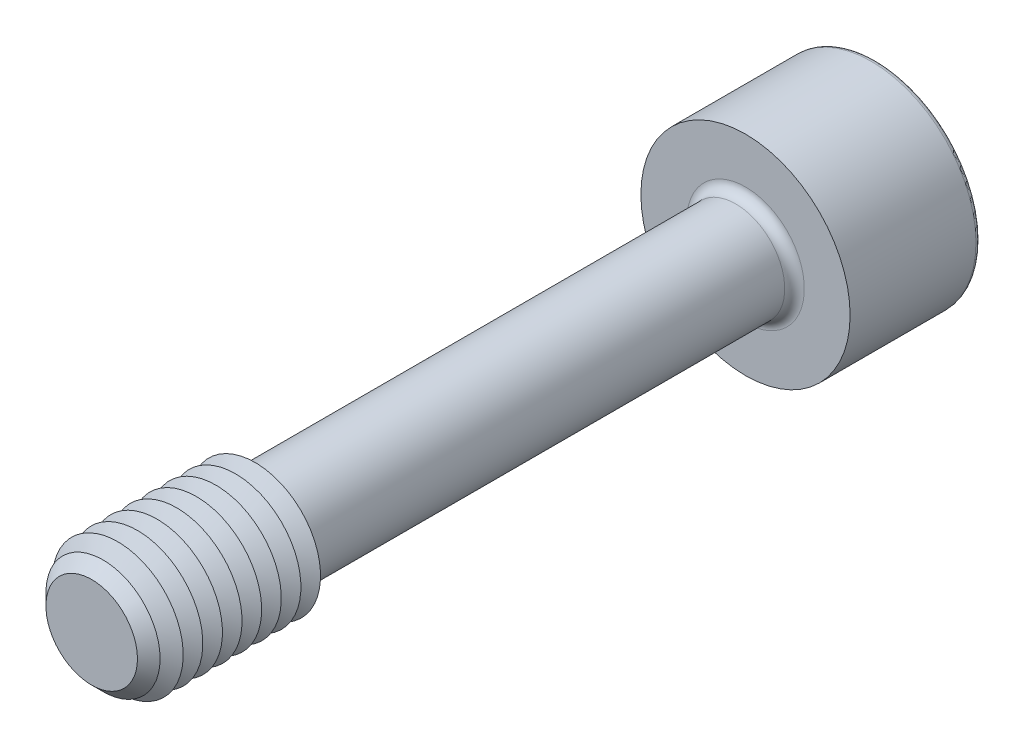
SolidWorks part; units mm, degrees
ref_plane "Front Plane" through (0, 0, 0) normal (0, 0, 1) x (1, 0, 0)
ref_plane "Top Plane" through (0, 0, 0) normal (0, 1, 0) x (1, 0, 0)
ref_plane "Right Plane" through (0, 0, 0) normal (1, 0, 0) x (0, 0, -1)
sketch "Sketch1" plane through (0, 0, 0) normal (0, 0, 1) x (1, 0, 0)
  circle A0 centre (0, 0) radius 3.75
  dimension "D1" = 7.5
extrude "Extrude1" add sketch "Sketch1" along normal mid plane 50
sketch "Sketch2" plane through (0, 0, 0) normal (1, 0, 0) x (0, 0, -1)
  line L0 (-25, 0) -> (-25, 5)
  line L1 (-25, 3.75) -> (-25, -3.75) construction
  line L2 (-25, 5) -> (-12.5, 5)
  line L3 (-12.5, 5) -> (-11.7783, 3.75)
  line L4 (25, 3.75) -> (-25, 3.75) construction
  line L5 (-11.7783, 3.75) -> (-11.7783, 0)
  line L6 (-11.7783, 0) -> (-25, 0)
  dimension "D1" = 5
  dimension "D2" = 120
  dimension "D3" = 12.5
revolve "Revolve1" add sketch "Sketch2" angle 360 about L6
chamfer "Chamfer1" distance 1.5 angle 45 1 edges at (0, 5, 25)
sketch "Sketch3" plane through (0, 0, -25) normal (0, 0, -1) x (-1, 0, 0)
  circle A0 centre (0, 0) radius 8
  dimension "D1" = 16
extrude "Extrude2" add sketch "Sketch3" along normal blind 10
sketch "Sketch4" plane through (-13.7, 0, -35) normal (0, 0, 1) x (1, 0, 0)
  line L2 (11.3906, -4) -> (16.0094, -4)
  line L3 (16.0094, -4) -> (18.3188, 0)
  line L4 (18.3188, 0) -> (16.0094, 4)
  line L6 (16.0094, 4) -> (11.3906, 4)
  line L7 (11.3906, 4) -> (9.0812, 0)
  line L8 (9.0812, 0) -> (11.3906, -4)
  circle A0 centre (13.7, 0) radius 4 construction
  dimension "D1" = 8
extrude "Extrude3" cut sketch "Sketch4" along normal blind 8
fillet "Fillet1" radius 0.75 1 edges at (-3.75, 0, -25)
fillet "Fillet2" radius 0.375 1 edges at (-8, 0, -35)
sketch "Sketch5" plane through (0, 0, 0) normal (1, 0, 0) x (0, 0, -1)
  line L0 (27, 0) -> (27, -4)
  line L1 (27, -4) -> (24.6906, 0)
  line L2 (24.6906, 0) -> (27, 0)
  dimension "D1" = 30
revolve "Cut-Revolve1" cut sketch "Sketch5" angle 360 about L2
sketch "Sketch6" plane through (0, 0, 0) normal (1, 0, 0) x (0, 0, -1)
  line L0 (1.332, 0) -> (-13.289, 0) construction
sketch "Sketch7" plane through (0, 0, 0) normal (1, 0, 0) x (0, 0, -1)
  line L0 (-12.5, 5) -> (-13.25, 3.701)
  line L1 (-13.25, 3.701) -> (-14, 5)
  line L2 (-12.5, 5) -> (-23.5, 5) construction
  line L3 (-14, 5) -> (-12.5, 5)
  dimension "D1" = 1.5
revolve "Cut-Revolve2" cut sketch "Sketch7" angle 360 about L0
pattern_linear "LPattern1" count 8 spacing 1.5 along (0, 0, 1) of "Cut-Revolve2"
